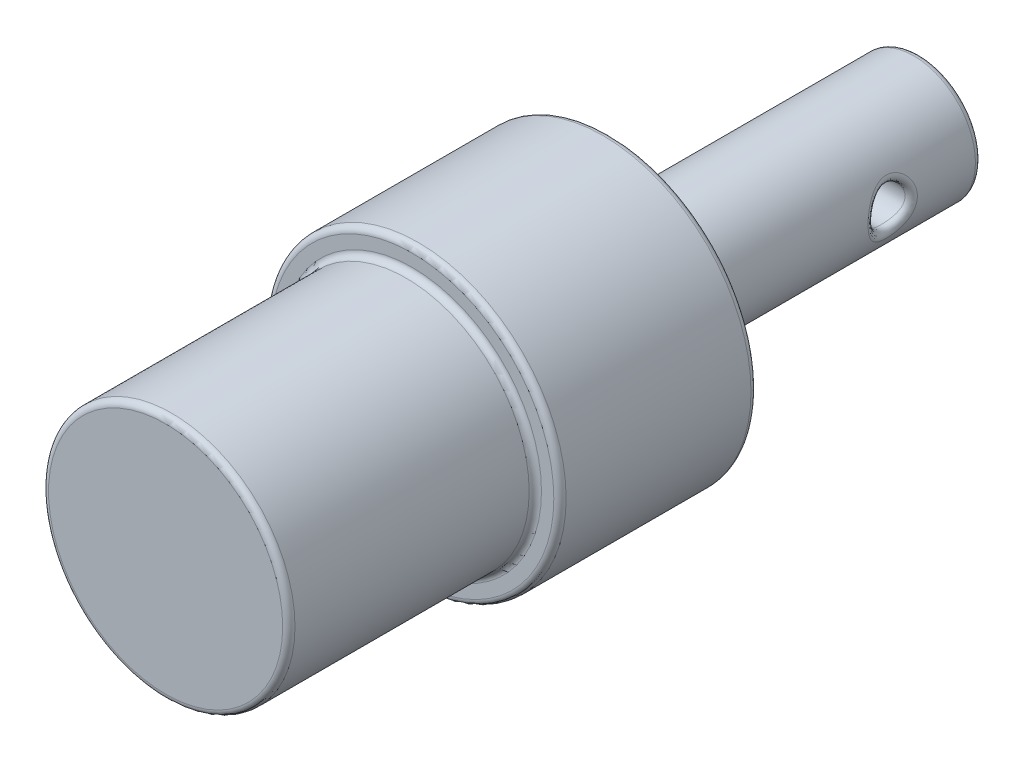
SolidWorks part; units mm, degrees
ref_plane "Спереди" through (0, 0, 0) normal (0, 0, 1) x (1, 0, 0)
ref_plane "Сверху" through (0, 0, 0) normal (0, 1, 0) x (1, 0, 0)
ref_plane "Справа" through (0, 0, 0) normal (1, 0, 0) x (0, 0, -1)
sketch "Эскиз1" plane through (0, 0, 0) normal (1, 0, 0) x (0, 0, -1)
  line L0 (64, 0) -> (0, 0)
  line L1 (0, 0) -> (0, 10)
  line L2 (0, 10) -> (20, 10)
  line L3 (20, 10) -> (20, 12)
  line L4 (20, 12) -> (36, 12)
  line L5 (36, 12) -> (36, 5)
  line L6 (36, 5) -> (60.9957, 5)
  line L7 (60.9957, 5) -> (64, 0)
  dimension "D1" = 10
  dimension "D2" = 12
  dimension "D3" = 20
  dimension "D4" = 16
  dimension "D5" = 28
  dimension "D6" = 59
  dimension "D7" = 5
revolve "Повернуть1" add sketch "Эскиз1" angle 360 about L0
sketch "Эскиз2" plane through (0, 0, 0) normal (1, 0, 0) x (0, 0, -1)
  line L0 (36, -5) -> (36, 5) construction
  circle A0 centre (54, 0) radius 1.5
  dimension "D2" = 3
  dimension "D1" = 18
extrude "Вырез-Вытянуть1" cut sketch "Эскиз2" against normal mid plane 10
fillet "Скругление1" radius 0.5 8 edges at (-5, 0, -60.9957) (-5, 0, -36) (-4.9926, 0.2714, -52.5248) (4.9926, -0.2714, -52.5248) (-12, 0, -36) (-12, 0, -20) (-10, 0, -20) (-10, 0, 0)
